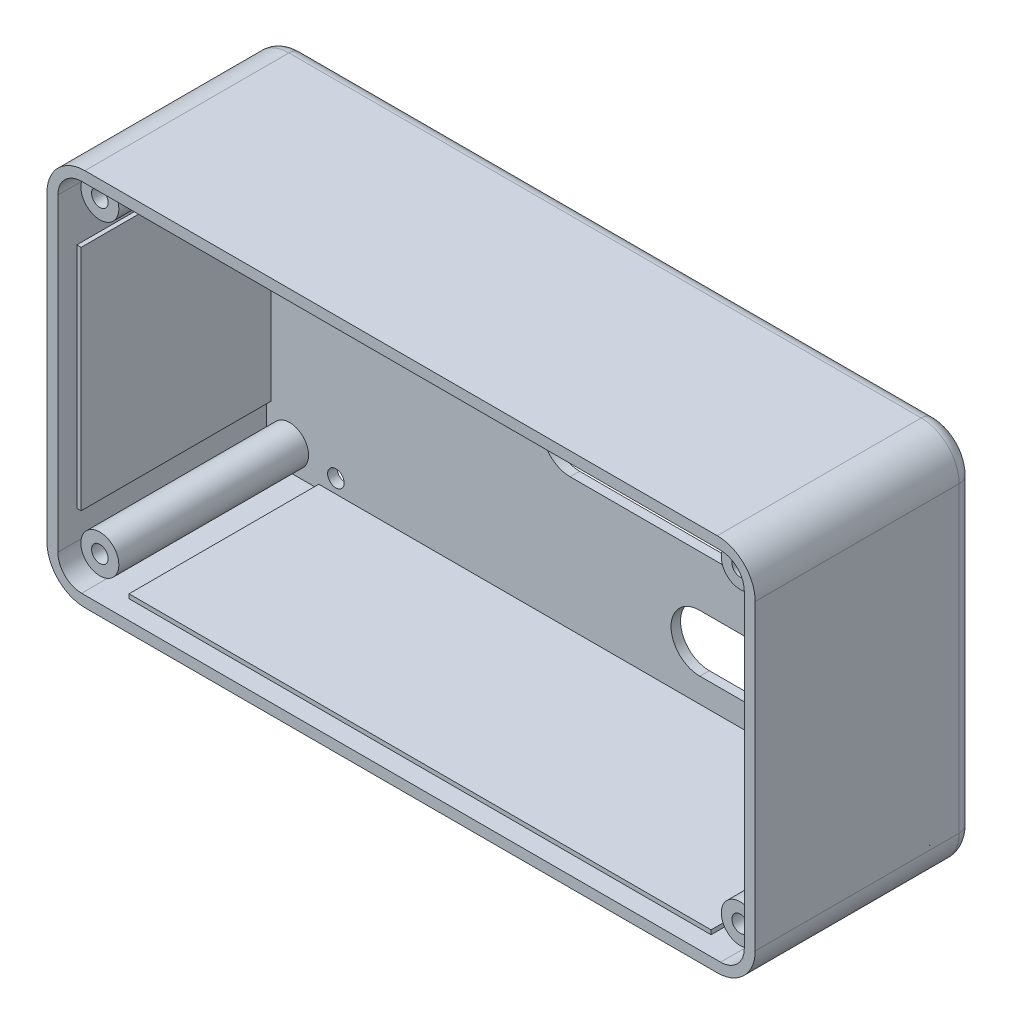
SolidWorks part; units mm, degrees
ref_plane "Face" through (0, 0, 0) normal (0, 0, 1) x (1, 0, 0)
ref_plane "Dessus" through (0, 0, 0) normal (0, 1, 0) x (1, 0, 0)
ref_plane "Droite" through (0, 0, 0) normal (1, 0, 0) x (0, 0, -1)
sketch "Esquisse1" plane through (0, 0, 0) normal (0, 0, 1) x (1, 0, 0)
  line L1 (-66.65, 39.9) -> (66.65, 39.9)
  line L2 (-74.65, 31.9) -> (-74.65, -31.9)
  line L3 (-66.65, -39.9) -> (66.65, -39.9)
  line L4 (74.65, 31.9) -> (74.65, -31.9)
  arc A0 (-74.65, 31.9) -> (-66.65, 39.9) centre (-66.65, 31.9) cw
  arc A1 (-66.65, -39.9) -> (-74.65, -31.9) centre (-66.65, -31.9) cw
  arc A2 (74.65, -31.9) -> (66.65, -39.9) centre (66.65, -31.9) cw
  arc A3 (66.65, 39.9) -> (74.65, 31.9) centre (66.65, 31.9) cw
  point P9 (-74.65, -39.9)
  point P14 (74.65, 39.9)
  dimension "D3" = 8
  dimension "D1" = 74.65
  dimension "D2" = 39.9
  dimension "D4" = 79.8
  dimension "D5" = 149.3
extrude "Extrusion1" add sketch "Esquisse1" along normal blind 46
fillet "Congé1" radius 3
sketch "Esquisse2" plane through (0, 0, 46) normal (0, 0, 1) x (1, 0, 0)
  line L0 (66.65, 39.9) -> (-66.65, 39.9) construction
  line L1 (-67.35, 37.6) -> (67.35, 37.6)
  line L2 (-72.35, 32.6) -> (-72.35, -32.6)
  line L3 (-67.35, -37.6) -> (67.35, -37.6)
  line L4 (72.35, 32.6) -> (72.35, -32.6)
  line L5 (-66.65, -39.9) -> (66.65, -39.9) construction
  line L6 (-74.65, 31.9) -> (-74.65, -31.9) construction
  line L7 (74.65, -31.9) -> (74.65, 31.9) construction
  arc A0 (-72.35, 32.6) -> (-67.35, 37.6) centre (-67.35, 32.6) cw
  arc A1 (-67.35, -37.6) -> (-72.35, -32.6) centre (-67.35, -32.6) cw
  arc A2 (72.35, -32.6) -> (67.35, -37.6) centre (67.35, -32.6) cw
  arc A3 (67.35, 37.6) -> (72.35, 32.6) centre (67.35, 32.6) cw
  dimension "D5" = 5
  dimension "D1" = 2.3
  dimension "D2" = 2.3
  dimension "D3" = 2.3
  dimension "D4" = 2.3
extrude "Enlèv. mat.-Extru.1" cut sketch "Esquisse2" against normal blind 4
sketch "Esquisse3" plane through (0, 0, 42) normal (0, 0, 1) x (1, 0, 0)
  line L0 (-61.35, 37.6) -> (-61.35, 36.7)
  line L1 (67.35, 37.6) -> (-67.35, 37.6) construction
  line L2 (-61.35, 36.7) -> (61.35, 36.7)
  line L3 (61.35, 36.7) -> (61.35, 37.6)
  line L4 (72.35, 21.5) -> (71.45, 21.5)
  line L5 (72.35, -32.6) -> (72.35, 32.6) construction
  line L6 (71.45, 21.5) -> (71.45, -26.6)
  line L7 (71.45, -26.6) -> (72.35, -26.6)
  line L8 (61.35, -37.6) -> (61.35, -36.7)
  line L9 (-67.35, -37.6) -> (67.35, -37.6) construction
  line L10 (61.35, -36.7) -> (-61.35, -36.7)
  line L11 (-61.35, -36.7) -> (-61.35, -37.6)
  line L12 (-72.35, -26.6) -> (-71.45, -26.6)
  line L13 (-72.35, 32.6) -> (-72.35, -32.6) construction
  line L14 (-71.45, -26.6) -> (-71.45, 21.5)
  line L15 (-71.45, 21.5) -> (-72.35, 21.5)
  line L16 (-74.65, 31.9) -> (-74.65, -31.9)
  line L17 (-66.65, -39.9) -> (66.65, -39.9)
  line L18 (-61.35, -37.6) -> (-67.35, -37.6)
  line L19 (72.35, -26.6) -> (72.35, -32.6)
  line L20 (-72.35, 21.5) -> (-72.35, 32.6)
  line L21 (-61.35, 37.6) -> (-67.35, 37.6)
  line L22 (72.35, 21.5) -> (72.35, 32.6)
  line L23 (61.35, 37.6) -> (67.35, 37.6)
  line L24 (61.35, -37.6) -> (67.35, -37.6)
  line L25 (-72.35, -26.6) -> (-72.35, -32.6)
  line L27 (74.65, 31.9) -> (74.65, -31.9)
  line L28 (66.65, 39.9) -> (-66.65, 39.9)
  line L29 (66.65, 39.9) -> (-66.65, 39.9) construction
  arc A8 (-74.65, 31.9) -> (-66.65, 39.9) centre (-66.65, 31.9) cw
  arc A9 (-72.35, 32.6) -> (-67.35, 37.6) centre (-67.35, 32.6) cw
  arc A10 (-67.35, -37.6) -> (-72.35, -32.6) centre (-67.35, -32.6) cw
  arc A11 (72.35, -32.6) -> (67.35, -37.6) centre (67.35, -32.6) cw
  arc A12 (67.35, 37.6) -> (72.35, 32.6) centre (67.35, 32.6) cw
  arc A13 (-66.65, -39.9) -> (-74.65, -31.9) centre (-66.65, -31.9) cw
  arc A14 (74.65, -31.9) -> (66.65, -39.9) centre (66.65, -31.9) cw
  arc A15 (66.65, 39.9) -> (74.65, 31.9) centre (66.65, 31.9) cw
  point P52 (-74.65, 39.9)
  dimension "D12" = 5
  dimension "D13" = 8
  dimension "D7" = 11
  dimension "D8" = 11
  dimension "D10" = 11
  dimension "D11" = 0.9
extrude "Enlèv. mat.-Extru.4" cut sketch "Esquisse3" against normal blind 40 flip side to cut
sketch "Esquisse4" plane through (0, 0, 2) normal (0, 0, 1) x (1, 0, 0)
  circle A0 centre (-67.5, 32.5) radius 4
  circle A1 centre (-67.5, 32.5) radius 1.75
  circle A2 centre (-67.5, -32.5) radius 4
  circle A3 centre (-67.5, -32.5) radius 1.75
  circle A4 centre (67.5, -32.5) radius 4
  circle A5 centre (67.5, -32.5) radius 1.75
  circle A6 centre (67.5, 32.5) radius 4
  circle A7 centre (67.5, 32.5) radius 1.75
  dimension "D5" = 3.5
  dimension "D6" = 8
  dimension "D1" = 135
  dimension "D2" = 65
  dimension "D3" = 32.5
  dimension "D4" = 67.5
extrude "Extrusion2" add sketch "Esquisse4" along normal blind 40
sketch "Esquisse5" plane through (0, 0, 0) normal (0, 0, -1) x (-1, 0, 0)
  line L0 (29.9525, 33.8699) -> (48.9522, 33.8699)
  line L1 (30.0075, 21.8701) -> (49.0072, 21.8701)
  line L4 (-36.3331, 29.93) -> (4.664, 29.93)
  line L5 (-36.3069, 17.93) -> (4.6893, 17.93)
  line L6 (-32.6631, 3.16) -> (8.334, 3.16)
  line L7 (-32.6369, -8.84) -> (8.3593, -8.84)
  line L8 (-46.8323, -19.5705) -> (-18.8323, -19.5705)
  line L9 (-46.8323, -31.5695) -> (-18.9877, -31.5695)
  line L10 (-74.65, -31.9) -> (-74.65, 31.9) construction
  line L11 (74.65, 31.9) -> (74.65, -31.9) construction
  line L12 (-66.65, 39.9) -> (66.65, 39.9) construction
  line L13 (66.65, -39.9) -> (-66.65, -39.9) construction
  circle A1 centre (-59.65, 32.9) radius 1.75
  circle A2 centre (57.74, 31.95) radius 1.75
  circle A3 centre (57.74, -33.82) radius 1.75
  circle A4 centre (-59.79, -34.63) radius 1.75
  arc A5 (-36.3331, 29.93) -> (-36.3069, 17.93) centre (-36.32, 23.93) ccw
  arc A6 (4.6893, 17.93) -> (4.664, 29.93) centre (4.68, 23.93) ccw
  arc A7 (-32.6631, 3.16) -> (-32.6369, -8.84) centre (-32.65, -2.84) ccw
  arc A8 (8.3593, -8.84) -> (8.334, 3.16) centre (8.35, -2.84) ccw
  arc A9 (29.9525, 33.8699) -> (30.0075, 21.8701) centre (29.98, 27.87) ccw
  arc A10 (49.0072, 21.8701) -> (48.9522, 33.8699) centre (48.98, 27.87) ccw
  arc A11 (-18.9877, -31.5695) -> (-18.8323, -19.5705) centre (-18.91, -25.57) ccw
  arc A12 (-46.8323, -19.5705) -> (-46.8323, -31.5695) centre (-46.91, -25.57) ccw
  point P10 (-36.32, 23.93)
  point P11 (-32.65, -2.84)
  point P12 (-46.91, -25.57)
  point P13 (29.98, 27.87)
  dimension "D25" = 7
  dimension "D4" = 65.77
  dimension "D7" = 15
  dimension "D9" = 23.33
  dimension "D17" = 12
  dimension "D23" = 8.97
  dimension "D24" = 1.9199
  dimension "D3" = 67.53
  dimension "D5" = 117.39
  dimension "D6" = 117.53
  dimension "D8" = 16.91
  dimension "D26" = 5.27
  dimension "D10" = 26.77
  dimension "D11" = 3.67
  dimension "D12" = 49.5
  dimension "D13" = 10.59
  dimension "D14" = 3.94
  dimension "D15" = 8.02
  dimension "D16" = 57.75
  dimension "D18" = 28
  dimension "D19" = 19
  dimension "D20" = 41
  dimension "D21" = 41
  dimension "D22" = 12.88
extrude "Enlèv. mat.-Extru.5" cut sketch "Esquisse5" against normal blind 5
